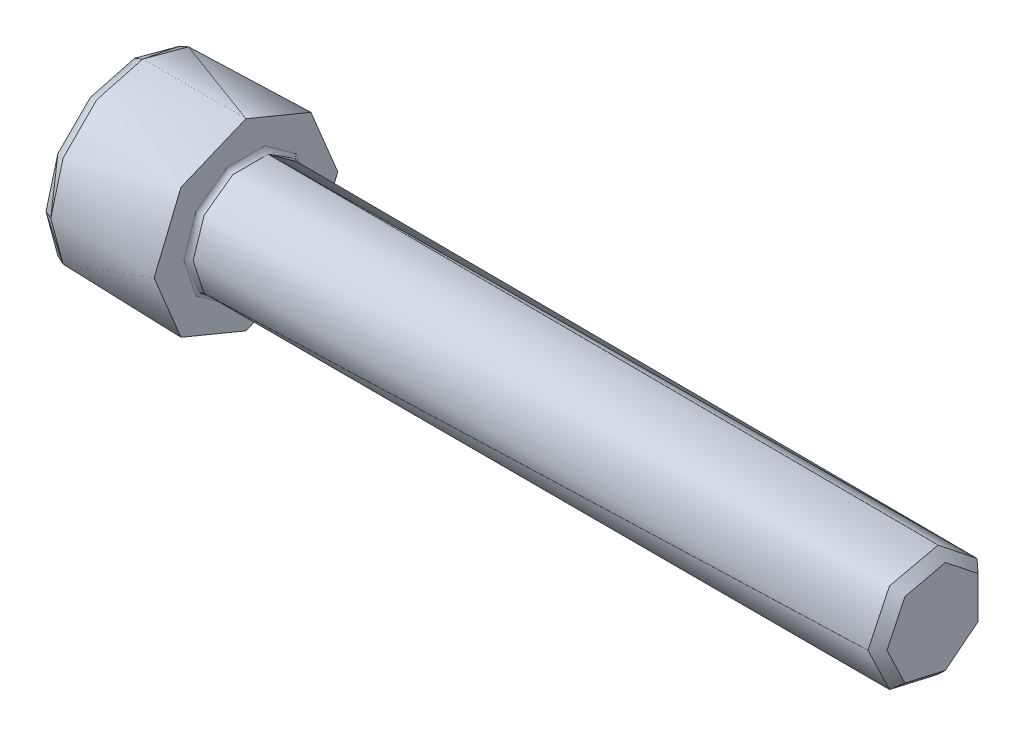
SolidWorks part; units mm, degrees
ref_plane "Plane1" through (0, 0, 0) normal (0, 0, 1) x (1, 0, 0)
ref_plane "Plane2" through (0, 0, 0) normal (0, 1, 0) x (1, 0, 0)
ref_plane "Plane3" through (0, 0, 0) normal (1, 0, 0) x (0, 0, -1)
sketch "BodySke" plane through (0, 0, 0) normal (0, 0, 1) x (1, 0, 0)
  line L0 (0, 0) -> (0, 8)
  line L1 (0, 8) -> (10, 8)
  line L2 (10, 8) -> (10, 5)
  line L3 (10, 5) -> (49.172, 5)
  line L4 (50, 4.172) -> (50, 0)
  line L5 (50, 0) -> (0, 0)
  line L6 (-31.75, 0) -> (127, 0) construction
  line L8 (50, 4.172) -> (49.172, 5)
  line L10 (50, -4.172) -> (49.172, -5) construction
  line L11 (11.5, 9.525) -> (11.5, 3.175) construction
  line L12 (10, 9.525) -> (10, 3.175) construction
  line L13 (-10, 9.525) -> (-10, 3.175) construction
  dimension "Diameter" = 10
  dimension "Head_ht" = 10
  dimension "Length" = 40
  dimension "Body_ch_ang" = 45
  dimension "Head_dia" = 16
  dimension "Minor_dia" = 8.344
  dimension "Advance" = 1.5
  dimension "Thread_nom" = 40
  dimension "Thread_length" = 60
revolve "Base-Revolve" add sketch "BodySke"
fillet "Fillet1" radius 0.4 1 edges at (10, 0, 5)
fillet "Fillet2" radius 1 1 edges at (0, 0, 8)
sketch "Sketch2" plane through (0, 0, 0) normal (0, 0, 1) x (1, 0, 0)
  line L0 (0, 4.0125) -> (5, 4.0125)
  line L1 (5, 4.0125) -> (7.3166, 0)
  line L2 (-31.75, 0) -> (127, 0) construction
  line L3 (7.3166, 0) -> (0, 0)
  line L4 (0, 0) -> (0, 4.0125)
  line L6 (0, 0) -> (47.625, 0) construction
  dimension "D1" = 4.0125
  dimension "D2" = 60
  dimension "Depth" = 5
revolve "Hex-PreBroach" cut sketch "Sketch2" angle 360 about L6
sketch "Sketch3" plane through (0, 0, 0) normal (-1, 0, 0) x (0, 0.5, 0.866)
  line L0 (2.3166, 4.0125) -> (-2.3166, 4.0125)
  line L1 (-2.3166, 4.0125) -> (-4.6332, 0)
  line L2 (2.3166, 4.0125) -> (4.6332, 0)
  line L3 (2.3166, -4.0125) -> (4.6332, 0)
  line L4 (2.3166, -4.0125) -> (-2.3166, -4.0125)
  line L5 (-2.3166, -4.0125) -> (-4.6332, 0)
  dimension "D1" = 4.0125
  dimension "D2" = 4.0125
  dimension "Hex_size" = 8.025
extrude "Hex" cut sketch "Sketch3" against normal blind 5
sketch "ThdSchSke" plane through (0, 0, 0) normal (0, 0, 1) x (1, 0, 0)
  line L0 (14.5, -4.172) -> (13.9202, -5)
  line L1 (14.5, -4.172) -> (15.0798, -5)
  line L2 (15.0798, -5) -> (15.0798, -6.25)
  line L3 (-3.175, 0) -> (5.1513, 0) construction
  line L4 (0, 7) -> (0, -7) construction
  line L5 (15.0798, -6.25) -> (13.9202, -6.25)
  line L6 (13.9202, -6.25) -> (13.9202, -5)
  dimension "Thread_minor" = 8.344
  dimension "Diameter" = 10
  dimension "Start" = 14.5
  dimension "SideAngle" = 55
  dimension "VeeAngle" = 70
  dimension "Overcut" = 12.5
revolve "ThreadSchematic" [suppressed] cut sketch "ThdSchSke" angle 360 about L3
pattern_linear "ThdSchPat" [suppressed]
equation "\"D2@Sketch3\" = \"Hex_size@Sketch3\" / 2"
equation "\"D1@Sketch3\" = \"Hex_size@Sketch3\" / 2"
equation "\"D1@Sketch2\" = \"Hex_size@Sketch3\" / 2"
equation "\"Thread_minor@ThreadCosmetic\"  =  \"Minor_dia@BodySke\""
equation "\"Depth@Sketch2\" =  \"Key_eng@Hex\""
equation "\"Thread_length@ThreadCosmetic\" = ((sgn( (\"Length@BodySke\" - \"Advance@BodySke\" * 3.0) - \"Thread_nom@BodySke\" )-1)*( (\"Length@BodySke\" - \"Advance@BodySke\" * 3.0) - \"Thread_nom@BodySke\" ))/-2+ \"Thread_no"
equation "\"Thread_minor@ThdSchSke\" = \"Minor_dia@BodySke\""
equation "\"Diameter@ThdSchSke\" = \"Diameter@BodySke\""
equation "\"Overcut@ThdSchSke\" = \"Diameter@BodySke\" * 1.25"
equation "\"Start@ThdSchSke\" = \"Head_ht@BodySke\" + \"Length@BodySke\" - \"Thread_length@ThreadCosmetic\"  '---Non-countersunk---"
equation "\"Num_threads@ThdSchPat\" = int( \"Thread_length@ThreadCosmetic\" / \"Advance@BodySke\" + 0.999 )  + 1"
equation "\"Advance@ThdSchPat\" = \"Thread_length@ThreadCosmetic\" /  (\"Num_threads@ThdSchPat\" - 1) 'relax it"
equation "\"Num_threads@ThdSchPat\" = \"Num_threads@ThdSchPat\" - sgn( \"Num_threads@ThdSchPat\" - 1) '---chamfered tips only---"
